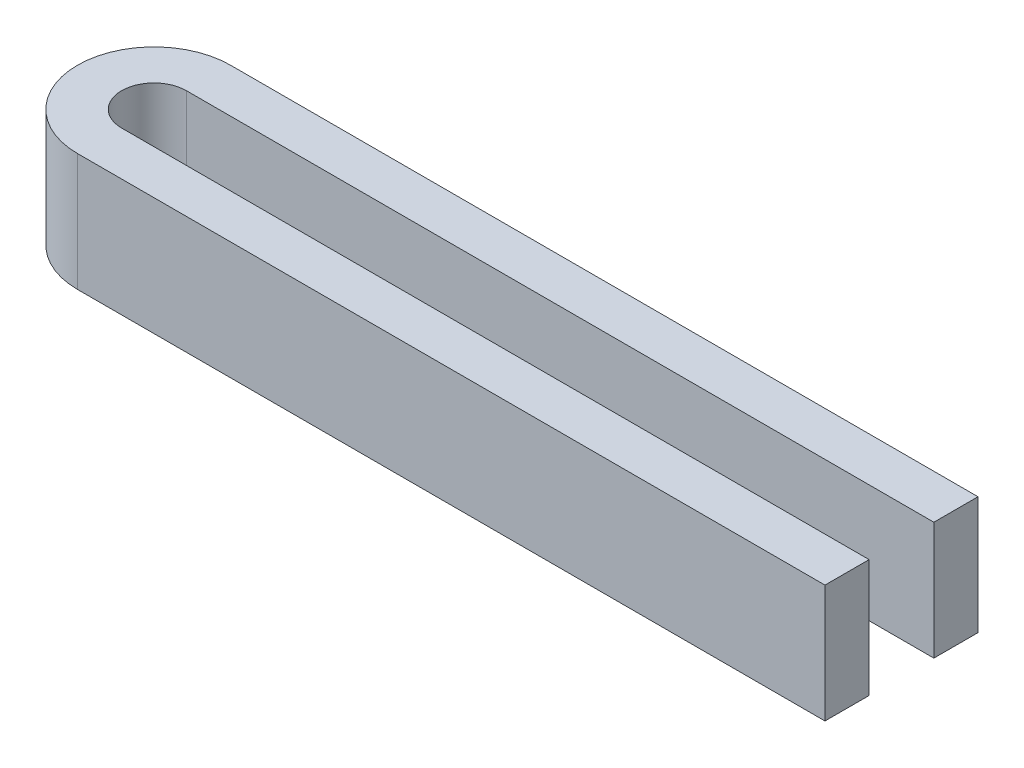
SolidWorks part; units mm, degrees
ref_plane "Plan de face" through (0, 0, 0) normal (0, 0, 1) x (1, 0, 0)
ref_plane "Plan de dessus" through (0, 0, 0) normal (0, 1, 0) x (1, 0, 0)
ref_plane "Plan de droite" through (0, 0, 0) normal (1, 0, 0) x (0, 0, -1)
sketch "Esquisse1" plane through (0, 0, 0) normal (0, 1, 0) x (1, 0, 0)
  line L3 (0, 26) -> (254, 26)
  line L4 (254, 26) -> (254, 11)
  line L5 (254, 11) -> (0, 11)
  line L6 (0, 0) -> (67.9822, 0) construction
  line L7 (254, -11) -> (0, -11)
  line L8 (254, -26) -> (254, -11)
  line L9 (0, -26) -> (254, -26)
  arc A0 (0, 11) -> (0, -11) centre (0, 0) ccw
  arc A1 (0, 26) -> (0, -26) centre (0, 0) ccw
  dimension "D2" = 280
  dimension "D1" = 22
  dimension "D4" = 52
extrude "Boss.-Extru.1" add sketch "Esquisse1" along normal blind 40
